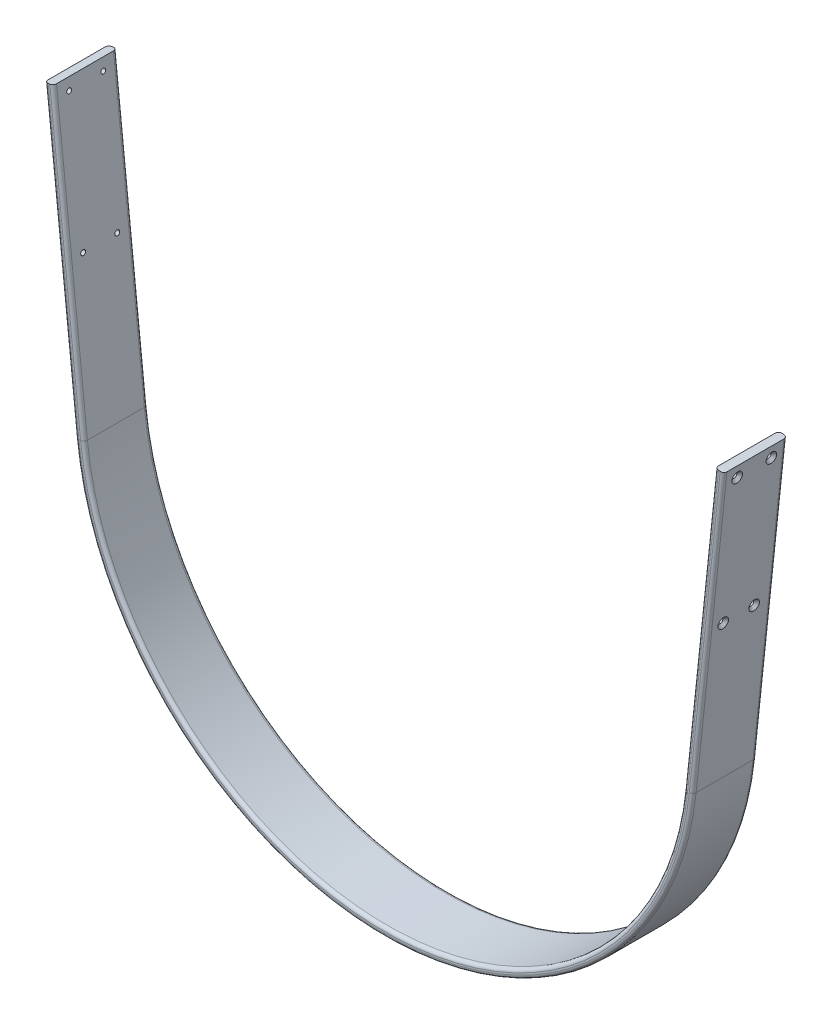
SolidWorks part; units mm, degrees
ref_plane "Face" through (0, 0, 0) normal (0, 0, 1) x (1, 0, 0)
ref_plane "Dessus" through (0, 0, 0) normal (0, 1, 0) x (1, 0, 0)
ref_plane "Droite" through (0, 0, 0) normal (1, 0, 0) x (0, 0, -1)
sketch "Esquisse1" plane through (0, 0, 0) normal (0, 0, 1) x (1, 0, 0)
  line L0 (-527.0966, 416.7006) -> (-527.0966, 85.8548) construction
  line L1 (529.399, 474.5786) -> (529.399, 142.3383) construction
  line L2 (542.0144, -56.968) -> (596.1602, 458.1943)
  line L5 (596.1602, 458.1943) -> (581.2423, 459.7623)
  line L6 (-542.0144, -56.968) -> (-596.1602, 458.1943)
  line L7 (-596.1602, 458.1943) -> (-581.2423, 459.7623)
  line L8 (-581.2423, 459.7623) -> (-527.0966, -55.4001)
  line L9 (581.2423, 459.7623) -> (527.0966, -55.4001)
  arc A0 (-542.0144, -56.968) -> (542.0144, -56.968) centre (0, 0) ccw
  arc A1 (-527.0966, -55.4001) -> (527.0966, -55.4001) centre (0, 0) ccw
  dimension "D2" = 530
  dimension "D3" = 6
  dimension "D4" = 518
  dimension "D5" = 6
  dimension "D1" = 15
extrude "Extrusion1" add sketch "Esquisse1" along normal mid plane 112
fillet "Congé2" radius 6
sketch "Esquisse2" plane through (-542.0144, -56.968, 0) normal (-0.9945, -0.1045, 0) x (0, 0, 1)
  line L0 (50, 518) -> (-50, 518) construction
  circle A0 centre (30, 498) radius 4.25
  circle A1 centre (-30, 498) radius 4.25
  circle A2 centre (30, 263) radius 4.25
  circle A3 centre (-30, 263) radius 4.25
  dimension "D1" = 8.5
  dimension "D2" = 60
  dimension "D5" = 235
  dimension "D3" = 30
  dimension "D4" = 20
extrude "Enlèv. mat.-Extru.1" cut sketch "Esquisse2" against normal blind 20
sketch "Esquisse3" plane through (542.0144, -56.968, 0) normal (0.9945, -0.1045, 0) x (0, 0, -1)
  line L0 (-50, 518) -> (50, 518) construction
  circle A0 centre (30, 498) radius 4.25
  circle A1 centre (-30, 498) radius 4.25
  circle A2 centre (-30, 263) radius 4.25
  circle A3 centre (24.4242, 263) radius 4.25
  dimension "D3" = 8.5
  dimension "D1" = 60
  dimension "D2" = 30
  dimension "D4" = 235
  dimension "D5" = 20
extrude "Enlèv. mat.-Extru.2" cut sketch "Esquisse3" against normal blind 20
chamfer "Chanfrein1" distance 5 angle 45
